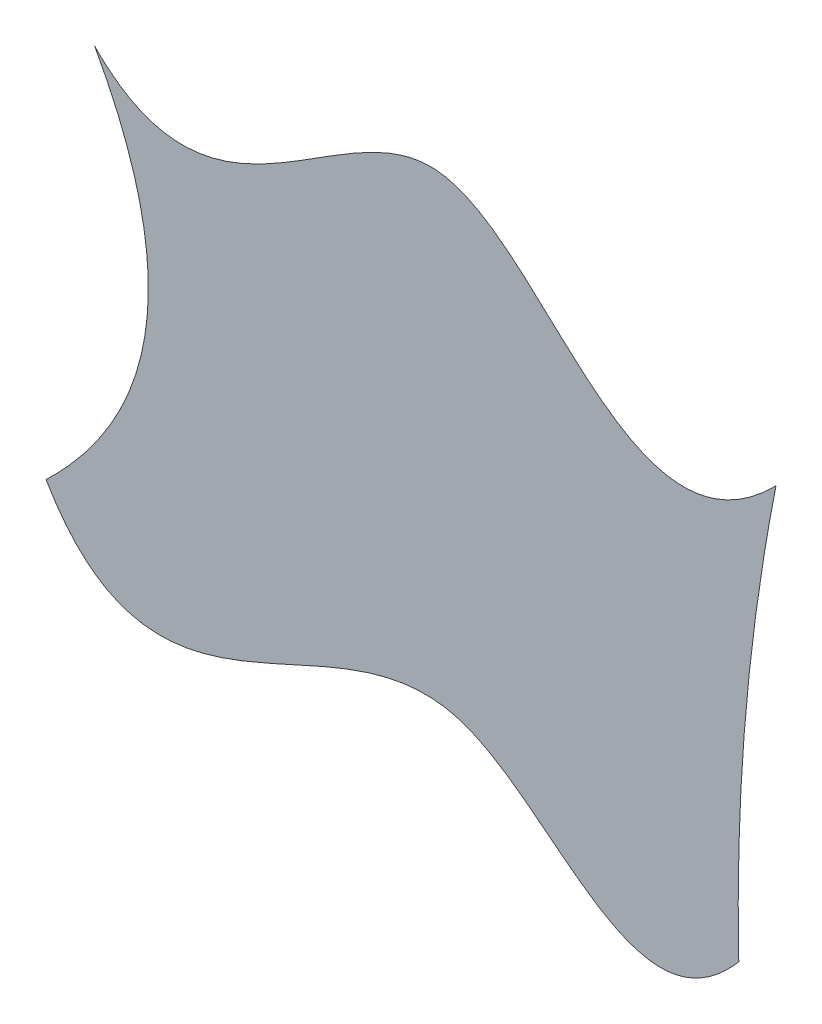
SolidWorks part; units mm, degrees
ref_plane "Front Plane" through (0, 0, 0) normal (0, 0, 1) x (1, 0, 0)
ref_plane "Top Plane" through (0, 0, 0) normal (0, 1, 0) x (1, 0, 0)
ref_plane "Right Plane" through (0, 0, 0) normal (1, 0, 0) x (0, 0, -1)
sketch "Sketch1" plane through (0, 0, 0) normal (0, 0, 1) x (1, 0, 0)
  spline S0 degree 2 poles (0, 0) (153.1513, 146.7124) (42.1923, 347.0392) knots 0 0 0 1 1 1
  spline S1 degree 3 poles (42.1923, 347.0392) (147.2758, 238.7517) (363.5982, 590.8081) (507.7592, 184.6725) (633.6691, 312.0918) knots 0 0 0 0 0.480187 1 1 1 1
  spline S2 degree 3 poles (0, 0) (97.0761, -166.4142) (344.4623, 175.293) (510.6654, -167.9675) (601.3796, -61.882) knots 0 0 0 0 0.575779 1 1 1 1
  spline S3 degree 2 poles (633.6691, 312.0918) (596.9022, 126.6958) (601.3796, -61.882) knots 0 0 0 1 1 1
surface "Surface-Plane1"
